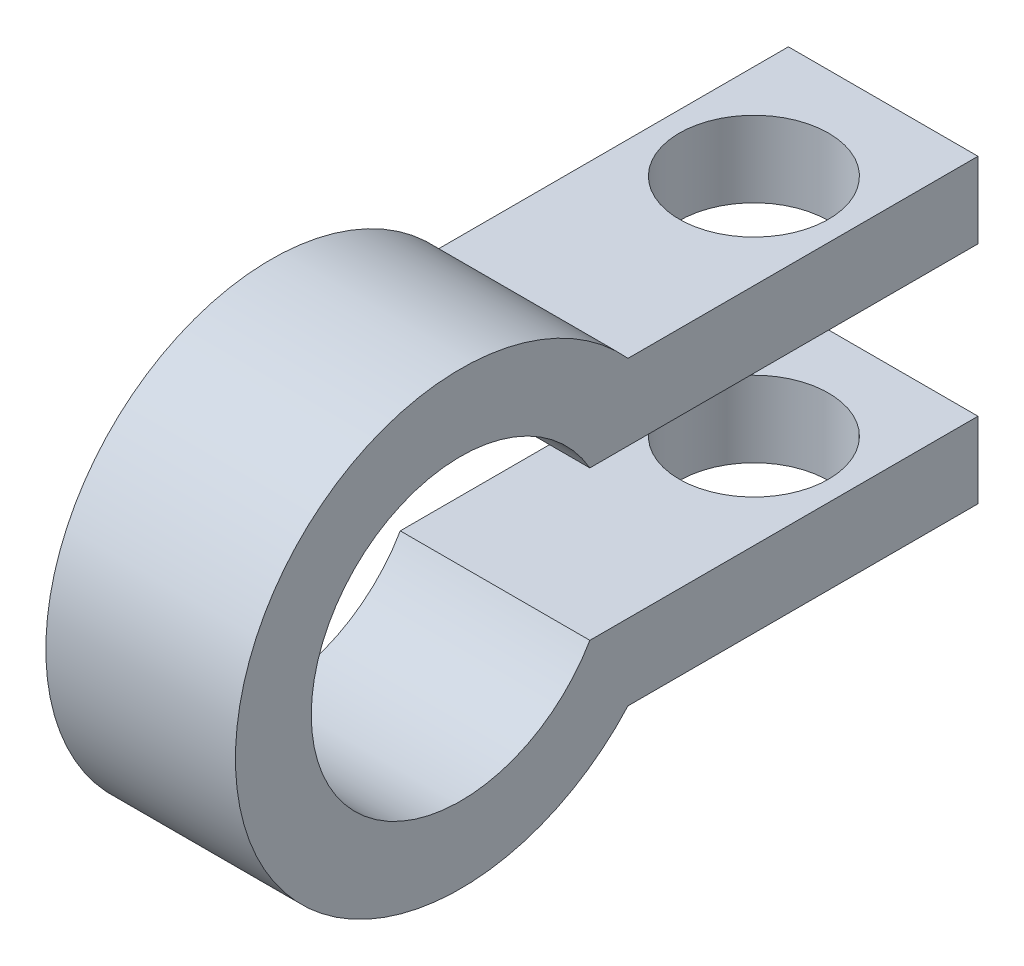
SolidWorks part; units mm, degrees
ref_plane "Front Plane" through (0, 0, 0) normal (0, 0, 1) x (1, 0, 0)
ref_plane "Top Plane" through (0, 0, 0) normal (0, 1, 0) x (1, 0, 0)
ref_plane "Right Plane" through (0, 0, 0) normal (1, 0, 0) x (0, 0, -1)
sketch "Sketch1" plane through (0, 0, 0) normal (1, 0, 0) x (0, 0, -1)
  line L0 (4.3301, 2.5) -> (17.3301, 2.5)
  line L1 (4.3301, -2.5) -> (17.3301, -2.5)
  arc A0 (4.3301, 2.5) -> (4.3301, -2.5) centre (0, 0) ccw
  dimension "D1" = 5
  dimension "D2" = 5
  dimension "D3" = 13
extrude "loop" add sketch "Sketch1" along normal mid plane 6.35 thin
sketch "Sketch2" plane through (0, 0, 0) normal (0, 1, 0) x (1, 0, 0)
  circle A0 centre (0, 13) radius 2.5
  dimension "D1" = 5
  dimension "D2" = 13
extrude "mount hole" cut sketch "Sketch2" against normal through all and the other way through all
